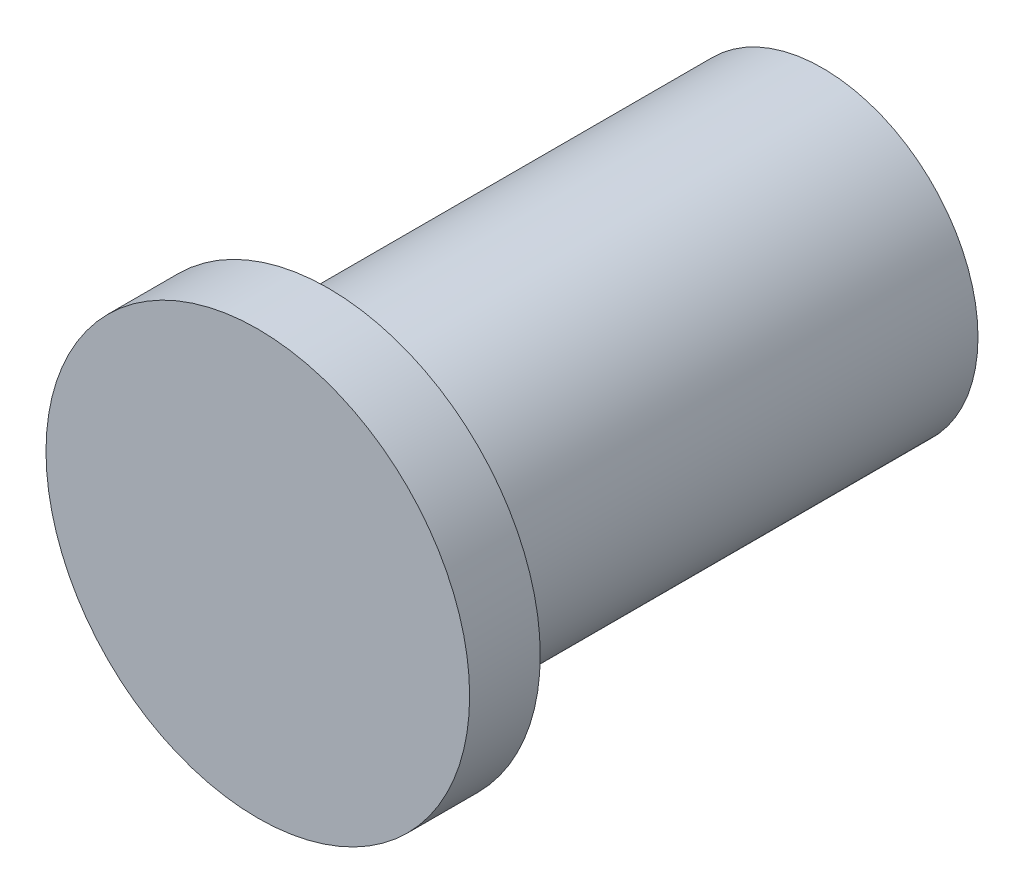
SolidWorks part; units mm, degrees
ref_plane "Front Plane" through (0, 0, 0) normal (0, 0, 1) x (1, 0, 0)
ref_plane "Top Plane" through (0, 0, 0) normal (0, 1, 0) x (1, 0, 0)
ref_plane "Right Plane" through (0, 0, 0) normal (1, 0, 0) x (0, 0, -1)
sketch "Sketch1" plane through (0, 0, 0) normal (0, 0, 1) x (1, 0, 0)
  circle A0 centre (0, 0) radius 13.97
extrude "Boss-Extrude1" add sketch "Sketch1" along normal blind 44.45
sketch "Sketch2" plane through (0, 0, 44.45) normal (0, 0, 1) x (1, 0, 0)
  circle A0 centre (0, 0) radius 19.05
extrude "Boss-Extrude2" add sketch "Sketch2" along normal blind 6.35
